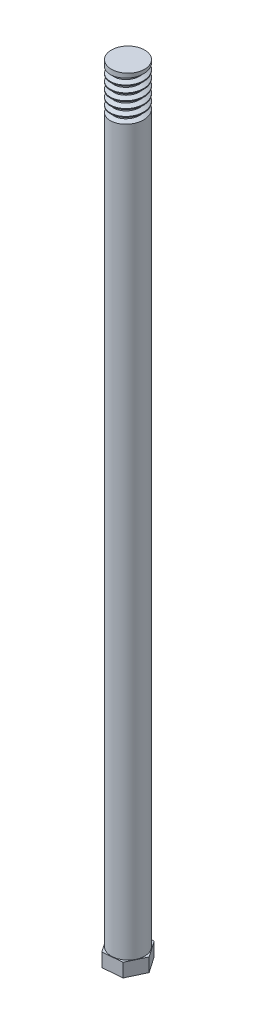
SolidWorks part; units mm, degrees
ref_plane "Front Plane" through (0, 0, 0) normal (0, 0, 1) x (1, 0, 0)
ref_plane "Top Plane" through (0, 0, 0) normal (0, 1, 0) x (1, 0, 0)
ref_plane "Right Plane" through (0, 0, 0) normal (1, 0, 0) x (0, 0, -1)
sketch "Sketch1" plane through (0, 0, 0) normal (0, 1, 0) x (1, 0, 0)
  circle A0 centre (0, 0) radius 2.45
extrude "Boss-Extrude1" add sketch "Sketch1" along normal blind 113
sketch "Sketch2" plane through (0, 0, 0) normal (0, -1, 0) x (1, 0, 0)
  line L0 (-1.6438, -2.373) -> (1.2332, -2.6101)
  line L1 (2.877, -0.2371) -> (1.6438, 2.373)
  line L2 (1.6438, 2.373) -> (-1.2332, 2.6101)
  line L3 (-1.2332, 2.6101) -> (-2.877, 0.2371)
  line L4 (-2.877, 0.2371) -> (-1.6438, -2.373)
  line L5 (1.2332, -2.6101) -> (2.877, -0.2371)
  circle A0 centre (0, 0) radius 2.5 construction
extrude "Boss-Extrude2" add sketch "Sketch2" along normal blind 2
thread "Thread2" pitch 1 start angle 0, offset 0, length 6, pitch 1, diameter 4.9
ref_plane "Plane2" through (-2.45, 113, 0) normal (0, 0, 1) x (-1, 0, 0)
sketch "Thread Profile2" plane through (-2.45, 113, 0) normal (0, 0, 1) x (-1, 0, 0)
  line L0 (0, 0) -> (0, 1) construction
  line L11 (0, 0) -> (0, 0.875)
  line L12 (0, 0.875) -> (-0.5413, 0.5625)
  line L13 (-0.5413, 0.5625) -> (-0.5413, 0.3125)
  line L15 (-0.5413, 0.3125) -> (0, 0)
  line L17 (-0.5413, 0.4375) -> (0, 0.4375) construction
  point P2 (0, 0)
  dimension "Pitch" = 1
  dimension "Profile_Angle" = 60
  dimension "Profile_Land" = 0.25
  dimension "Profile_Height" = 0.5413
